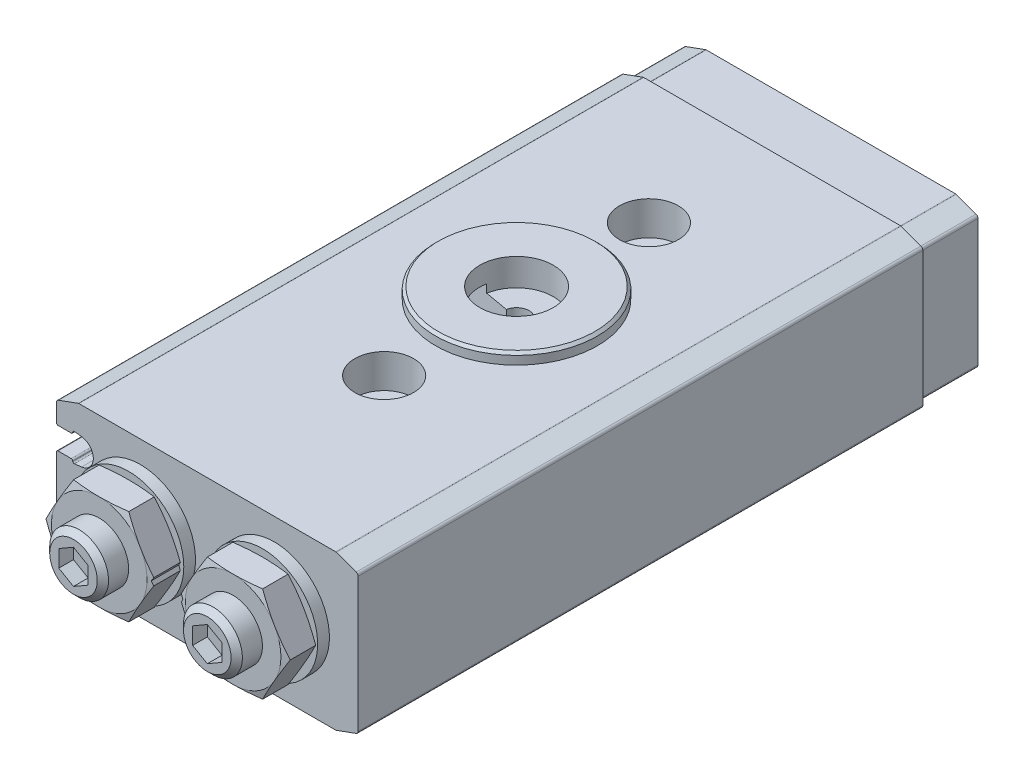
SolidWorks part; units mm, degrees
ref_plane "Ebene vorne" through (0, 0, 0) normal (0, 0, 1) x (1, 0, 0)
ref_plane "Ebene oben" through (0, 0, 0) normal (0, 1, 0) x (1, 0, 0)
ref_plane "Ebene rechts" through (0, 0, 0) normal (1, 0, 0) x (0, 0, -1)
imported_body "Importiert1"
other "1"
ref_plane "Ebene1" through (0, 18.2, 0) normal (0, 1, 0) x (-1, 0, 0)
sketch "Skizze1" plane through (0, 18.2, 0) normal (0, 1, 0) x (-1, 0, 0)
  line L0 (0, -42.05) -> (33.6551, -42.05) construction
  line L1 (0, -42.05) -> (-34.6054, -42.05) construction
  arc A0 (30, -42.05) -> (-30, -42.05) centre (0, -42.05) ccw
  dimension "D1" = 30
